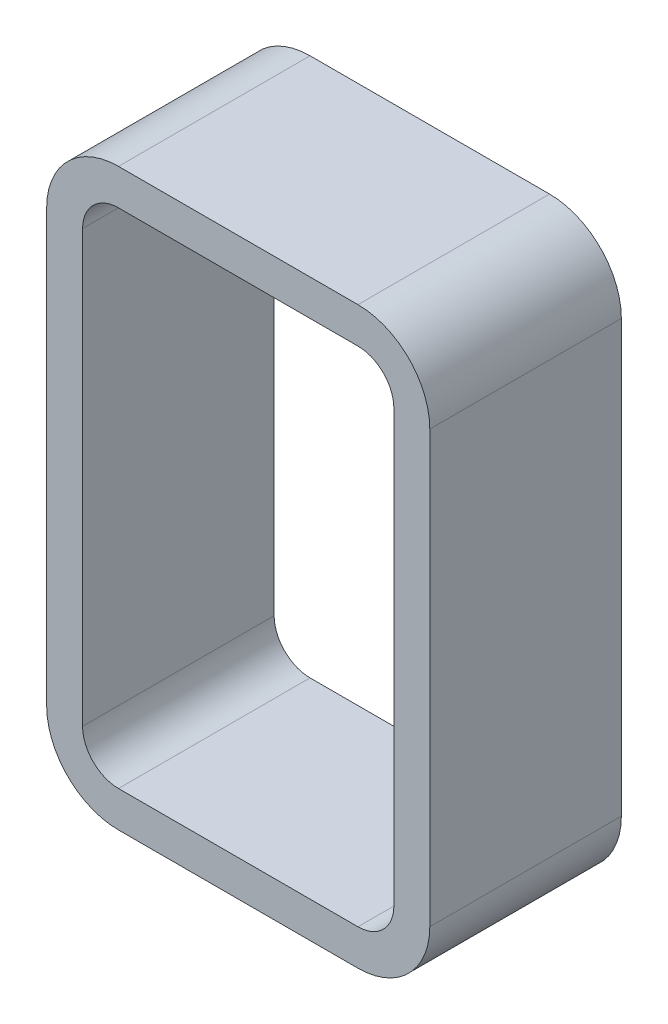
SolidWorks part; units mm, degrees
ref_plane "Plane1" through (0, 0, 0) normal (0, 0, 1) x (1, 0, 0)
ref_plane "Plane2" through (0, 0, 0) normal (0, 1, 0) x (1, 0, 0)
ref_plane "Plane3" through (0, 0, 0) normal (1, 0, 0) x (0, 0, -1)
sketch "Sketch1" plane through (0, 0, 0) normal (0, 0, 1) x (1, 0, 0)
  line L0 (9.525, 4.7625) -> (41.275, 4.7625)
  line L1 (4.7625, 9.525) -> (4.7625, 66.675)
  line L2 (41.275, 71.4375) -> (9.525, 71.4375)
  line L3 (46.0375, 66.675) -> (46.0375, 9.525)
  line L4 (9.525, 0) -> (41.275, 0)
  line L5 (0, 9.525) -> (0, 66.675)
  line L6 (41.275, 76.2) -> (9.525, 76.2)
  line L7 (50.8, 66.675) -> (50.8, 9.525)
  arc A0 (50.8, 66.675) -> (41.275, 76.2) centre (41.275, 66.675) ccw
  arc A1 (41.275, 0) -> (50.8, 9.525) centre (41.275, 9.525) ccw
  arc A2 (0, 9.525) -> (9.525, 0) centre (9.525, 9.525) ccw
  arc A3 (9.525, 76.2) -> (0, 66.675) centre (9.525, 66.675) ccw
  arc A4 (9.525, 71.4375) -> (4.7625, 66.675) centre (9.525, 66.675) ccw
  arc A5 (46.0375, 66.675) -> (41.275, 71.4375) centre (41.275, 66.675) ccw
  arc A6 (41.275, 4.7625) -> (46.0375, 9.525) centre (41.275, 9.525) ccw
  arc A7 (4.7625, 9.525) -> (9.525, 4.7625) centre (9.525, 9.525) ccw
extrude "BaseTubeR" add sketch "Sketch1" along normal mid plane 25.4
equation "\"D1@Sketch1\" = \"Thickness@Sketch1\" * 2"
